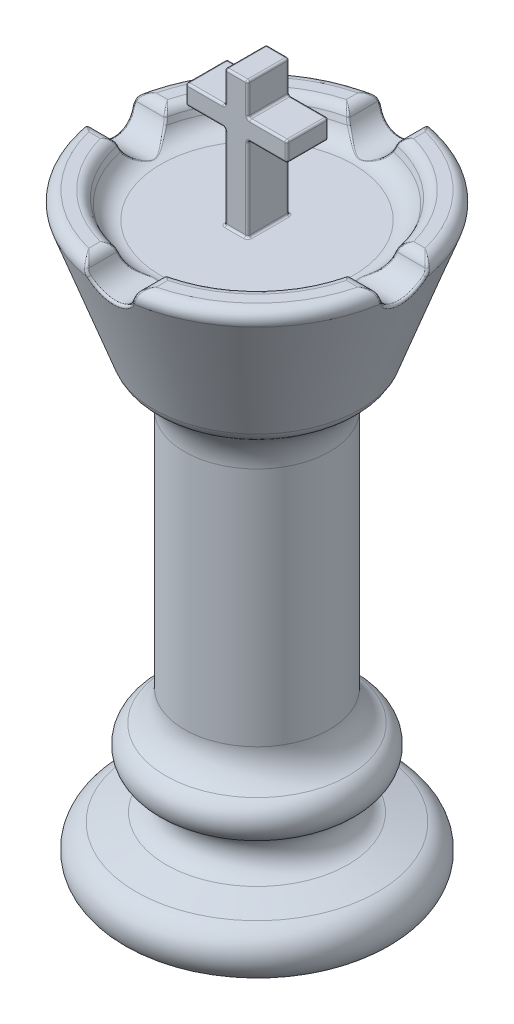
SolidWorks part; units mm, degrees
ref_plane "Front" through (0, 0, 0) normal (0, 0, 1) x (1, 0, 0)
ref_plane "Top" through (0, 0, 0) normal (0, 1, 0) x (1, 0, 0)
ref_plane "Right" through (0, 0, 0) normal (1, 0, 0) x (0, 0, -1)
sketch "Sketch1" plane through (0, 0, 0) normal (0, 0, 1) x (1, 0, 0)
  line L0 (0, 0) -> (0, 72.0534) construction
  line L1 (0, 0) -> (13.97, 0)
  line L2 (14.8003, 5.9807) -> (11.1344, 7.0186)
  line L3 (8.89, 20.2472) -> (8.89, 49.7112)
  line L4 (12.6183, 56.0518) -> (18.796, 73.025)
  line L5 (18.796, 73.025) -> (14.732, 73.025)
  line L6 (0, 69.85) -> (0, 0)
  line L7 (14.732, 73.025) -> (14.1847, 71.5213)
  line L8 (11.7979, 69.85) -> (0, 69.85)
  arc A0 (13.97, 0) -> (14.8003, 5.9807) centre (13.97, 3.048) ccw
  arc A1 (11.1344, 7.0186) -> (10.941, 11.8433) centre (11.8263, 9.4625) cw
  arc A2 (10.941, 11.8433) -> (11.2008, 16.4912) centre (10.0557, 14.224) ccw
  arc A3 (11.2008, 16.4912) -> (8.89, 20.2472) centre (13.0979, 20.2472) cw
  arc A4 (8.89, 49.7112) -> (11.6298, 54.8002) centre (14.986, 49.7112) cw
  arc A5 (11.7979, 69.85) -> (14.1847, 71.5213) centre (11.7979, 72.39) ccw
  arc A6 (12.6183, 56.0518) -> (11.6298, 54.8002) centre (10.2315, 56.9206) cw
  dimension "D2" = 3.048
  dimension "D4" = 2.54
  dimension "D5" = 2.54
  dimension "D7" = 8.89
  dimension "D8" = 4.064
  dimension "D9" = 3.175
  dimension "D11" = 6.096
  dimension "D12" = 14.224
  dimension "D13" = 29.464
  dimension "D14" = 13.97
  dimension "D15" = 11.8263
  dimension "D16" = 4.2079
  dimension "D3" = 3.81
  dimension "D6" = 69.85
  dimension "D10" = 110
  dimension "D17" = 18.796
revolve "Base-Revolve" add sketch "Sketch1" angle 360 about L0
sketch "Sketch2" plane through (0, 73.025, 0) normal (0, 1, 0) x (-1, 0, 0)
  line L0 (0, 0) -> (0, 21.3897) construction
  line L2 (0, 18.796) -> (-3.048, 18.796)
  line L3 (0, 18.796) -> (0, 12.446)
  line L4 (0, 12.446) -> (-3.048, 12.446)
  line L5 (-3.048, 18.796) -> (-3.048, 12.446)
  circle A1 centre (0, 0) radius 18.796 construction
  dimension "D1" = 3.048
  dimension "D2" = 6.35
revolve "Cut-Revolve1" cut sketch "Sketch2" angle 360 about L0
pattern_circular "CirPattern1" count 4 over 360 about axis through (0, 0, 0) along (0, 1, 0) of "Cut-Revolve1"
sketch "Sketch3" plane through (0, 0, 0) normal (0, 0, 1) x (1, 0, 0)
  line L0 (0, 69.85) -> (0, 86.5176)
  line L1 (0, 0) -> (0, 72.0534) construction
  line L2 (0, 86.5176) -> (1.4119, 86.5176)
  line L3 (1.4119, 86.5176) -> (1.4119, 82.5643)
  line L4 (1.4119, 82.5643) -> (6.2124, 82.5643)
  line L5 (6.2124, 82.5643) -> (6.2124, 80.164)
  line L6 (6.2124, 80.164) -> (1.4119, 80.164)
  line L7 (1.4119, 80.164) -> (1.4119, 69.85)
  line L8 (11.7979, 69.85) -> (-11.7979, 69.85) construction
  line L9 (1.4119, 69.85) -> (0, 69.85)
extrude "Boss-Extrude1" add sketch "Sketch3" along normal mid plane 5.08
mirror "Mirror1" about plane through (0, 69.85, 2.54) normal (1, 0, 0) of "Boss-Extrude1"
fillet "Fillet1" radius 1.27 24 edges at (-10.4171, 73.025, 10.4171) (-13.2908, 73.025, 13.2908) (3.048, 73.025, 16.4802) (-0.4065, 70.0042, 17.6919) (-3.048, 73.025, 16.4802) (-2.8751, 72.0129, 14.073) (10.4171, 73.025, 10.4171) (13.2908, 73.025, 13.2908) (16.4802, 73.025, -3.048) (17.6919, 70.0042, 0.4065) (16.4802, 73.025, 3.048) (14.073, 72.0129, 2.8751) (10.4171, 73.025, -10.4171) (13.2908, 73.025, -13.2908) (-3.048, 73.025, -16.4802) (0.4065, 70.0042, -17.6919) (3.048, 73.025, -16.4802) (2.8751, 72.0129, -14.073) (-10.4171, 73.025, -10.4171) (-13.2908, 73.025, -13.2908) (-16.4802, 73.025, 3.048) (-17.6919, 70.0042, -0.4065) (-16.4802, 73.025, -3.048) (-14.073, 72.0129, -2.8751)
fillet "Fillet2" radius 0.254 84 edges at (-1.4119, 69.85, 0) (1.4119, 69.85, 0) (14.5078, 72.8022, 3.4085) (14.5078, 72.8022, -3.4085) (17.4071, 72.7802, 3.3775) (17.4071, 72.7802, -3.3775) (3.4085, 72.8022, -14.5078) (-3.4085, 72.8022, -14.5078) (3.3775, 72.7802, -17.4071) (-3.3775, 72.7802, -17.4071) (-14.5078, 72.8022, -3.4085) (-14.5078, 72.8022, 3.4085) (-17.4071, 72.7802, 3.3775) (-17.4071, 72.7802, -3.3775) (-3.3775, 72.7802, 17.4071) (3.3775, 72.7802, 17.4071) (-3.4085, 72.8022, 14.5078) (3.4085, 72.8022, 14.5078) (1.4119, 75.007, -2.54) (3.8122, 80.164, -2.54) (3.8122, 82.5643, -2.54) (1.4119, 84.541, -2.54) (-1.4119, 84.541, -2.54) (-1.4119, 84.541, 2.54) (-3.8122, 82.5643, -2.54) (-3.8122, 82.5643, 2.54) (-3.8122, 80.164, -2.54) (-3.8122, 80.164, 2.54) (-1.4119, 75.007, -2.54) (-1.4119, 75.007, 2.54) (0, 69.85, -2.54) (1.4119, 84.541, 2.54) (3.8122, 82.5643, 2.54) (3.8122, 80.164, 2.54) (1.4119, 75.007, 2.54) (0, 69.85, 2.54) (1.4119, 86.5176, 0) (0, 86.5176, 2.54) (-1.4119, 82.5643, 0) (-1.4119, 86.5176, 0) (0, 86.5176, -2.54) (-6.2124, 82.5643, 0) (-6.2124, 81.3642, -2.54) (-6.2124, 81.3642, 2.54) (-6.2124, 80.164, 0) (6.2124, 80.164, 0) (6.2124, 81.3642, 2.54) (6.2124, 82.5643, 0) (6.2124, 81.3642, -2.54) (17.6919, 70.0042, 0.4065) (18.0436, 71.6947, 2.7424) (12.6031, 69.9814, 0.1631) (18.0406, 71.7572, -2.7718) (0.4065, 70.0042, -17.6919) (2.7424, 71.6947, -18.0436) (0.1631, 69.9814, -12.6031) (-2.7718, 71.7572, -18.0406) (-18.0436, 71.6947, -2.7424) (-12.6031, 69.9814, -0.1631) (-18.0406, 71.7572, 2.7718) (-17.6919, 70.0042, -0.4065) (-0.1631, 69.9814, 12.6031) (2.7718, 71.7572, 18.0406) (-0.4065, 70.0042, 17.6919) (-2.7424, 71.6947, 18.0436) (-1.4119, 80.164, 0) (1.4119, 80.164, 0) (1.4119, 82.5643, 0)
